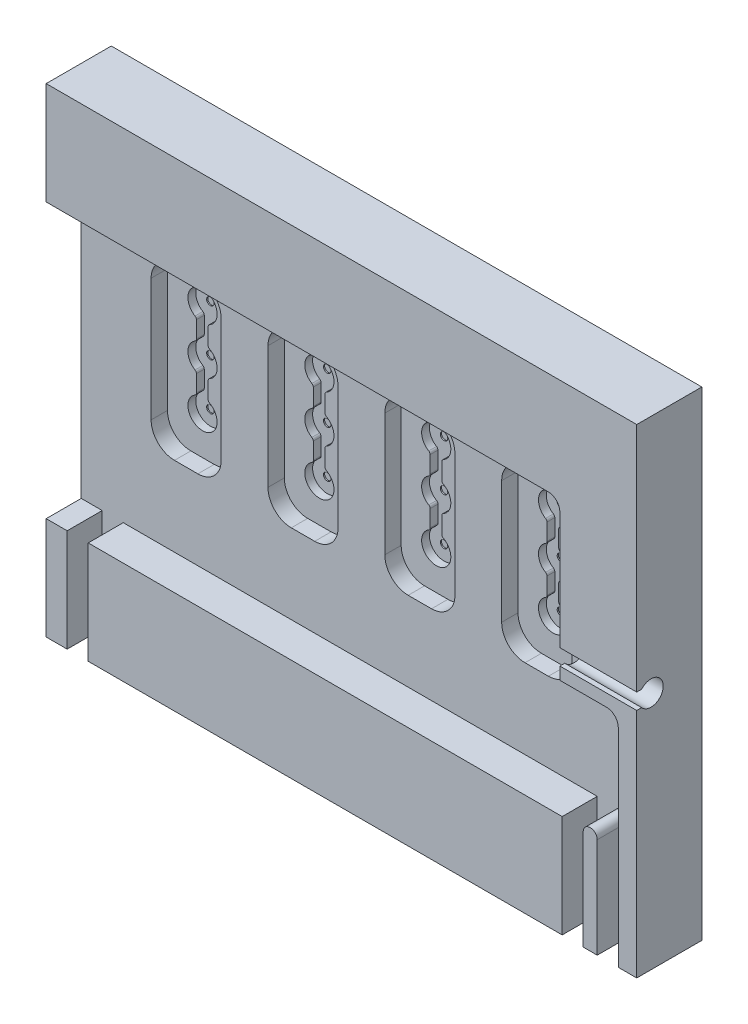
SolidWorks part; units mm, degrees
ref_plane "Front Plane" through (0, 0, 0) normal (0, 0, 1) x (1, 0, 0)
ref_plane "Top Plane" through (0, 0, 0) normal (0, 1, 0) x (1, 0, 0)
ref_plane "Right Plane" through (0, 0, 0) normal (1, 0, 0) x (0, 0, -1)
sketch "Sketch1" plane through (0, 0, 0) normal (0, 0, 1) x (1, 0, 0)
  line L1 (0, 0) -> (48, 0)
  line L2 (0, 0) -> (0, 31.47)
  line L3 (0, 31.47) -> (48, 31.47)
  line L4 (48, 0) -> (48, 31.47)
  dimension "D1" = 48
  dimension "D2" = 31.47
extrude "Extrude1" add sketch "Sketch1" along normal blind 5.15
sketch "Sketch2" plane through (0, 0, 5.15) normal (0, 0, 1) x (1, 0, 0)
  line L0 (48, 31.47) -> (0, 31.47) construction
  line L1 (6, 27.47) -> (42, 27.47)
  line L2 (4, 25.47) -> (4, 6)
  line L3 (6, 4) -> (42, 4)
  line L4 (44, 25.47) -> (44, 6)
  line L5 (48, 0) -> (48, 31.47) construction
  line L6 (0, 0) -> (48, 0) construction
  line L7 (0, 31.47) -> (0, 0) construction
  line L9 (44, 27.47) -> (42, 27.47)
  line L10 (44, 27.47) -> (44, 25.47)
  arc A0 (4, 25.47) -> (6, 27.47) centre (6, 25.47) cw
  arc A1 (6, 4) -> (4, 6) centre (6, 6) cw
  arc A3 (42, 4) -> (44, 6) centre (42, 6) ccw
  point P14 (4, 27.47)
  point P17 (4, 4)
  dimension "D6" = 2
  dimension "D7" = 2
  dimension "D1" = 4
  dimension "D2" = 4
  dimension "D3" = 4
  dimension "D4" = 23.47
  dimension "D5" = 4
extrude "Cut-Extrude1" cut sketch "Sketch2" against normal blind 2.58
sketch "Sketch6" plane through (0, 0, 2.57) normal (0, 0, 1) x (1, 0, 0)
  line L0 (8.4979, 20.774) -> (8.4979, 19.346)
  line L1 (9.4979, 20.7484) -> (9.4979, 19.3716)
  line L2 (8.4979, 16.774) -> (8.4979, 15.346)
  line L3 (9.4979, 16.7484) -> (9.4979, 15.3716)
  line L4 (44, 27.47) -> (6, 27.47) construction
  line L5 (9.02, 22.06) -> (9.02, 18.06) construction
  line L6 (9.02, 18.06) -> (9.02, 14.06) construction
  line L7 (4, 25.47) -> (4, 6) construction
  line L8 (10.27, 22.06) -> (10.27, 18.06) construction
  line L9 (10.27, 18.06) -> (10.27, 14.06) construction
  arc A0 (9.6266, 20.967) -> (8.3766, 20.9883) centre (9.02, 22.06) ccw
  arc A1 (9.6266, 16.967) -> (9.6266, 19.153) centre (9.02, 18.06) ccw
  arc A2 (8.3766, 15.1317) -> (9.6266, 15.153) centre (9.02, 14.06) ccw
  arc A3 (8.3766, 19.1317) -> (8.3766, 16.9883) centre (9.02, 18.06) ccw
  arc A4 (9.4979, 20.7484) -> (9.6266, 20.967) centre (9.7479, 20.7484) cw
  arc A5 (9.6266, 19.153) -> (9.4979, 19.3716) centre (9.7479, 19.3716) cw
  arc A6 (9.4979, 16.7484) -> (9.6266, 16.967) centre (9.7479, 16.7484) cw
  arc A7 (9.6266, 15.153) -> (9.4979, 15.3716) centre (9.7479, 15.3716) cw
  arc A8 (8.4979, 15.346) -> (8.3766, 15.1317) centre (8.2479, 15.346) cw
  arc A9 (8.3766, 16.9883) -> (8.4979, 16.774) centre (8.2479, 16.774) cw
  arc A10 (8.4979, 19.346) -> (8.3766, 19.1317) centre (8.2479, 19.346) cw
  arc A11 (8.3766, 20.9883) -> (8.4979, 20.774) centre (8.2479, 20.774) cw
  dimension "D2" = 4.16
  dimension "D1" = 1
  dimension "D3" = 5.02
extrude "Cut-Extrude2" cut sketch "Sketch6" against normal blind 2.07
sketch "Sketch10" plane through (0, 0, 2.57) normal (0, 0, 1) x (1, 0, 0)
  line L1 (10.02, 10.8102) -> (8.02, 10.8102)
  line L2 (12.02, 12.8102) -> (12.02, 23.3098)
  line L3 (10.02, 25.3098) -> (8.02, 25.3098)
  line L4 (6.02, 12.8102) -> (6.02, 23.3098)
  arc A0 (9.6266, 20.967) -> (8.3766, 20.9883) centre (9.02, 22.06) ccw construction
  arc A1 (8.3766, 15.1317) -> (9.6266, 15.153) centre (9.02, 14.06) ccw construction
  arc A2 (6.02, 23.3098) -> (8.02, 25.3098) centre (8.02, 23.3098) cw
  arc A3 (8.02, 10.8102) -> (6.02, 12.8102) centre (8.02, 12.8102) cw
  arc A4 (12.02, 12.8102) -> (10.02, 10.8102) centre (10.02, 12.8102) cw
  arc A5 (10.02, 25.3098) -> (12.02, 23.3098) centre (10.02, 23.3098) cw
  arc A8 (8.3766, 19.1317) -> (8.3766, 16.9883) centre (9.02, 18.06) ccw construction
  point P4 (9.0413, 23.3098)
  point P8 (9.0413, 12.8102)
  dimension "D3" = 3
  dimension "D5" = 2
  dimension "D1" = 2
  dimension "D2" = 2
  dimension "D4" = 3
extrude "Cut-Extrude6" cut sketch "Sketch10" against normal blind 1.4
pattern_linear "LPattern1" count 4 spacing 10 along (1, 0, 0) of "Cut-Extrude2", "Cut-Extrude6"
sketch "Sketch7" plane through (0, 0, 0.5) normal (0, 0, 1) x (1, 0, 0)
  circle A0 centre (9.02, 22.06) radius 0.3175
  circle A1 centre (9.02, 18.06) radius 0.3175
  circle A2 centre (9.02, 14.06) radius 0.3175
extrude "Cut-Extrude3" cut sketch "Sketch7" against normal blind 0.1
pattern_linear "LPattern2" count 4 spacing 10 along (1, 0, 0) of "Cut-Extrude3"
sketch "Sketch8" plane through (0, 0, 0) normal (-1, 0, 0) x (0, 0, 1)
  line L0 (5.15, 0) -> (5.15, 31.47) construction
  line L1 (5.15, 0) -> (0, 0) construction
  circle A0 centre (4.33, 7) radius 0.889
  circle A1 centre (4.33, 10.5) radius 0.889
  circle A2 centre (4.33, 14) radius 0.889
  circle A3 centre (4.33, 21) radius 0.889
  dimension "D1" = 0.82
  dimension "D2" = 3.5
  dimension "D3" = 3.5
  dimension "D4" = 7
  dimension "D5" = 7
extrude "Cut-Extrude4" [suppressed] cut sketch "Sketch8" against normal up to surface (48 mm away)
sketch "Sketch9" plane through (48, 0, 0) normal (1, 0, 0) x (0, 0, -1)
  line L0 (-5.15, 31.47) -> (0, 31.47) construction
  line L1 (-5.15, 0) -> (-5.15, 31.47) construction
  circle A0 centre (-4.35, 23.735) radius 0.9
  circle A1 centre (-4.35, 19.735) radius 0.9
  circle A2 centre (-4.35, 15.735) radius 0.9
  circle A3 centre (-4.35, 11.735) radius 0.9
  circle A4 centre (-4.35, 7.735) radius 0.9
  dimension "D1" = 4
  dimension "D2" = 4
  dimension "D3" = 4
  dimension "D4" = 4
  dimension "D5" = 7.735
  dimension "D6" = 0.8
extrude "Cut-Extrude5" [suppressed] cut sketch "Sketch9" against normal up to surface (4 mm away)
sketch "Sketch11" plane through (0, 0, 5.15) normal (0, 0, 1) x (1, 0, 0)
  line L0 (0, 31.47) -> (0, 0) construction
  line L1 (6, 4) -> (0, 4)
  line L2 (6, 4) -> (6, 27.47)
  line L3 (6, 27.47) -> (0, 27.47)
  line L4 (0, 4) -> (0, 27.47)
extrude "Cut-Extrude7" cut sketch "Sketch11" against normal blind 2.58
sketch "Sketch16" plane through (48, 0, 0) normal (1, 0, 0) x (0, 0, -1)
  line L1 (-5.15, 31.47) -> (0, 31.47)
  line L2 (-5.15, 31.47) -> (-5.15, 0)
  line L3 (-5.15, 0) -> (0, 0)
  line L4 (0, 31.47) -> (0, 0)
extrude "Extrude2" add sketch "Sketch16" along normal blind 2.58
sketch "Sketch17" plane through (50.58, 0, 0) normal (1, 0, 0) x (0, 0, -1)
  circle A1 centre (-4.35, 15.735) radius 1.05
extrude "Cut-Extrude11" cut sketch "Sketch17" against normal up to next
sketch "Sketch14" plane through (0, 0, 5.15) normal (0, 0, 1) x (1, 0, 0)
  line L0 (49, 0) -> (47.2, 0)
  line L1 (44, 14) -> (49, 14)
  line L2 (44, 14) -> (44, 6)
  line L3 (44, 6) -> (42, 6)
  line L4 (49, 14) -> (49, 0)
  line L5 (45.8, 0) -> (44, 0)
  line L6 (44, 4) -> (44, 0)
  line L7 (44, 4) -> (42, 4)
  line L8 (42, 6) -> (42, 4)
  line L9 (45.8, 3.7823) -> (47.2, 3.7823) construction
  line L10 (45.8, 0) -> (45.8, 3.7823)
  line L11 (45.8, 3.7823) -> (47.2, 3.7823)
  line L12 (47.2, 0) -> (47.2, 3.7823)
  dimension "D1" = 5
  dimension "D2" = 14
  dimension "D3" = 1.8
  dimension "D4" = 1.8
extrude "Cut-Extrude9" cut sketch "Sketch14" against normal up to surface (2.58 mm away)
sketch "Sketch18" plane through (0, 0, 5.15) normal (0, 0, 1) x (1, 0, 0)
  line L3 (45.8, 3.7823) -> (45.8, 0)
  line L4 (45.8, 0) -> (47.2, 0)
  line L5 (47.2, 0) -> (47.2, 3.7823)
  line L6 (44, 27.47) -> (44, 16.4151)
  line L7 (44, 16.4151) -> (50.58, 16.4151)
  line L8 (50.58, 16.4151) -> (50.58, 31.47)
  line L9 (50.58, 31.47) -> (0, 31.47)
  line L10 (0, 31.47) -> (0, 27.47)
  line L11 (0, 27.47) -> (44, 27.47)
  line L12 (44, 27.47) -> (44, 16.4151)
  line L13 (44, 16.4151) -> (50.58, 16.4151)
  line L14 (50.58, 16.4151) -> (50.58, 31.47)
  line L15 (50.58, 31.47) -> (0, 31.47)
  line L16 (0, 31.47) -> (0, 27.47)
  line L17 (0, 27.47) -> (44, 27.47)
  line L18 (44, 14) -> (49, 14)
  line L19 (49, 14) -> (49, 0)
  line L20 (49, 0) -> (50.58, 0)
  line L21 (50.58, 0) -> (50.58, 15.0549)
  line L22 (50.58, 15.0549) -> (44, 15.0549)
  line L23 (44, 15.0549) -> (44, 14)
  line L24 (44, 14) -> (49, 14)
  line L25 (49, 14) -> (49, 0)
  line L26 (49, 0) -> (50.58, 0)
  line L27 (50.58, 0) -> (50.58, 15.0549)
  line L28 (50.58, 15.0549) -> (44, 15.0549)
  line L29 (44, 15.0549) -> (44, 14)
  line L30 (45.8, 3.7823) -> (45.8, 0)
  line L31 (45.8, 0) -> (47.2, 0)
  line L32 (47.2, 0) -> (47.2, 3.7823)
  line L34 (44, 0) -> (44, 4)
  line L35 (44, 4) -> (0, 4)
  line L36 (0, 4) -> (0, 0)
  line L37 (0, 0) -> (44, 0)
  line L38 (44, 0) -> (44, 4)
  line L39 (44, 4) -> (0, 4)
  line L40 (0, 4) -> (0, 0)
  line L41 (0, 0) -> (44, 0)
  line L42 (47.2, 3.7823) -> (45.8, 3.7823)
  line L43 (47.2, 3.7823) -> (45.8, 3.7823)
  dimension "D1" = 0
  dimension "D2" = 0
  dimension "D3" = 0
  dimension "D4" = 0
extrude "Extrude3" add sketch "Sketch18" along normal blind 0.42
sketch "Sketch19" plane through (0, 0, 0) normal (-1, 0, 0) x (0, 0, 1)
  line L16 (0, 0) -> (5.57, 0)
  line L17 (5.57, 0) -> (5.57, 4)
  line L18 (5.57, 4) -> (2.57, 4)
  line L19 (2.57, 4) -> (2.57, 27.47)
  line L20 (2.57, 27.47) -> (5.57, 27.47)
  line L21 (5.57, 27.47) -> (5.57, 31.47)
  line L22 (5.57, 31.47) -> (0, 31.47)
  line L23 (0, 31.47) -> (0, 0)
  line L24 (0, 0) -> (5.57, 0)
  line L25 (5.57, 0) -> (5.57, 4)
  line L26 (5.57, 4) -> (2.57, 4)
  line L27 (2.57, 4) -> (2.57, 27.47)
  line L28 (2.57, 27.47) -> (5.57, 27.47)
  line L29 (5.57, 27.47) -> (5.57, 31.47)
  line L30 (5.57, 31.47) -> (0, 31.47)
  line L31 (0, 31.47) -> (0, 0)
  dimension "D1" = 0
extrude "Cut-Extrude12" cut sketch "Sketch19" against normal blind 0.04
sketch "Sketch20" plane through (0, 0, 5.57) normal (0, 0, 1) x (1, 0, 0)
  line L1 (44, 4) -> (44.2, 4)
  line L2 (44, 4) -> (44, 0)
  line L3 (44, 0) -> (44.2, 0)
  line L4 (44.2, 4) -> (44.2, 0)
  dimension "D1" = 0.2
extrude "Extrude4" add sketch "Sketch20" against normal up to surface (3 mm away)
sketch "Sketch21" plane through (0, 0, 5.57) normal (0, 0, 1) x (1, 0, 0)
  line L0 (45.8, 0) -> (47.2, 0) construction
  line L1 (45.8, 3.7823) -> (46, 3.7823)
  line L2 (45.8, 3.7823) -> (45.8, 0)
  line L3 (45.8, 0) -> (46, 0)
  line L4 (46, 3.7823) -> (46, 0)
  dimension "D1" = 0.2
extrude "Cut-Extrude13" cut sketch "Sketch21" against normal up to surface (3 mm away)
sketch "Sketch24" plane through (0, 0, 5.57) normal (0, 0, 1) x (1, 0, 0)
  line L1 (47.2, 3.7823) -> (46, 3.7823) construction
  circle A0 centre (46.6, 3.7823) radius 0.6
extrude "Extrude5" add sketch "Sketch24" against normal up to surface (3 mm away)
sketch "Sketch25" plane through (0, 0, 5.57) normal (0, 0, 1) x (1, 0, 0)
  line L0 (0.04, 27.47) -> (0.04, 31.47) construction
  line L1 (0.04, 36.245) -> (50.58, 36.245)
  line L2 (0.04, 36.245) -> (0.04, 31.47)
  line L3 (0.04, 31.47) -> (50.58, 31.47)
  line L4 (50.58, 36.245) -> (50.58, 31.47)
  line L5 (0.04, 0) -> (50.58, 0)
  line L6 (0.04, 0) -> (0.04, -4.775)
  line L7 (0.04, -4.775) -> (50.58, -4.775)
  line L8 (50.58, 0) -> (50.58, -4.775)
extrude "Extrude6" add sketch "Sketch25" against normal up to surface (5.57 mm away)
sketch "Sketch26" plane through (0, 0, 5.57) normal (0, 0, 1) x (1, 0, 0)
  line L0 (0.04, -4.775) -> (50.58, -4.775) construction
  line L1 (44.2, 0) -> (46, 0)
  line L2 (44.2, 0) -> (44.2, -4.775)
  line L3 (44.2, -4.775) -> (46, -4.775)
  line L4 (46, 0) -> (46, -4.775)
  line L6 (47.2, 0) -> (49, 0)
  line L7 (47.2, 0) -> (47.2, -4.775)
  line L8 (47.2, -4.775) -> (49, -4.775)
  line L9 (49, 0) -> (49, -4.775)
extrude "Cut-Extrude14" cut sketch "Sketch26" against normal up to surface (3 mm away)
fillet "Fillet1" radius 1 2 edges at (49, 14, 4.07)
fillet "Fillet2" radius 1 1 edges at (44, 27.47, 4.07)
sketch "Sketch27" plane through (0, 0, 5.57) normal (0, 0, 1) x (1, 0, 0)
  line L4 (1.836, -4.925) -> (3.636, -4.925)
  line L7 (1.836, 4) -> (3.636, 4)
  line L11 (1.836, 4) -> (3.636, 4)
  line L12 (1.836, 4) -> (1.836, -4.925)
  line L13 (1.836, -4.925) -> (3.636, -4.925)
  line L14 (3.636, 4) -> (3.636, -4.925)
extrude "Cut-Extrude16" cut sketch "Sketch27" against normal up to surface (3 mm away) contours L14 L12 M3 M1
